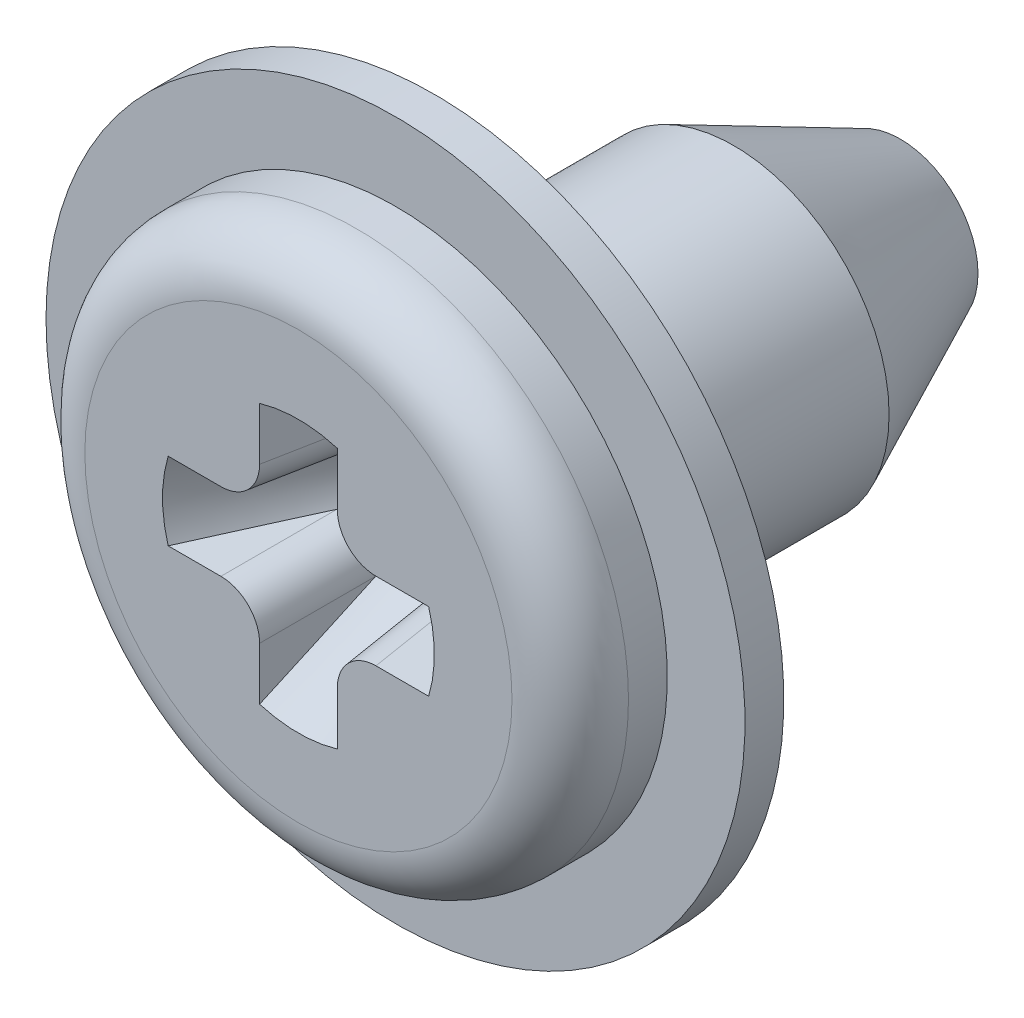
SolidWorks part; units mm, degrees
ref_plane "Plan1" through (0, 0, 0) normal (0, 0, 1) x (1, 0, 0)
ref_plane "Plan2" through (0, 0, 0) normal (0, 1, 0) x (1, 0, 0)
ref_plane "Plan3" through (0, 0, 0) normal (1, 0, 0) x (0, 0, -1)
sketch "Esquisse1" plane through (0, 0, 0) normal (0, 0, 1) x (1, 0, 0)
  circle A0 centre (0, 0) radius 2
  dimension "D1" = 4
extrude "Base-Extrusion" add sketch "Esquisse1" along normal blind 6
sketch "Esquisse2" plane through (0, 0, 6) normal (0, 0, 1) x (1, 0, 0)
  circle A2 centre (0, 0) radius 3.5
  circle A3 centre (0, 0) radius 3.5
  dimension "D1" = 1.5
extrude "Boss.-Extru.1" add sketch "Esquisse2" along normal blind 1.75
chamfer "Chanfrein1" distance 1 angle 65
sketch "Esquisse11" plane through (0, 0, 6) normal (0, 0, -1) x (-1, 0, 0)
  circle A0 centre (0, 0) radius 4.5
  dimension "D1" = 9
extrude "Boss.-Extru.7" add sketch "Esquisse11" against normal blind 0.5
sketch "Esquisse8" plane through (0, 0, 7.75) normal (0, 0, 1) x (1, 0, 0)
  circle A0 centre (0, 0) radius 1.75
  dimension "D1" = 3.5
extrude "Enlèv. mat.-Extru.4" cut sketch "Esquisse8" against normal blind 1.5 draft 30
sketch "Esquisse9" plane through (0, 0, 6.25) normal (0, 0, 1) x (1, 0, 0)
  circle A1 centre (0, 0) radius 0.884 construction
  circle A2 centre (0, 0) radius 0.884
extrude "Enlèv. mat.-Extru.5" cut sketch "Esquisse9" against normal blind 0.85 draft 45
sketch "Esquisse10" plane through (0, 0, 7.75) normal (0, 0, 1) x (1, 0, 0)
  line L0 (2.9698, 0) -> (-2.8626, 0) construction
  line L1 (0, 2.7331) -> (0, -2.6438) construction
  line L2 (0.5, 2) -> (0.5, 0.5)
  line L3 (0.5, 0.5) -> (2, 0.5)
  line L4 (-0.5, 2) -> (0.5, 2)
  line L5 (2, 0.5) -> (2, -0.5)
  line L6 (0.5, -2) -> (-0.5, -2)
  line L7 (0.5, -0.5) -> (2, -0.5)
  line L8 (0.5, -2) -> (0.5, -0.5)
  line L9 (-0.5, -2) -> (-0.5, -0.5)
  line L10 (-0.5, -0.5) -> (-2, -0.5)
  line L11 (-2, 0.5) -> (-2, -0.5)
  line L12 (-0.5, 0.5) -> (-2, 0.5)
  line L13 (-0.5, 2) -> (-0.5, 0.5)
  circle A0 centre (0, 0) radius 2.5
  point P13 (2.0588, 0)
  point P17 (0, -2)
  point P18 (0, 2)
  point P20 (-2.0588, 0)
  point P23 (0.5, 0.5)
  point P26 (-0.5, 0.5)
  point P29 (-0.5, -0.5)
  point P32 (0.5, -0.5)
  point P34 (0, 2)
  dimension "D1" = 1
  dimension "D2" = 2
  dimension "D3" = 5
extrude "Boss.-Extru.6" add sketch "Esquisse10" against normal blind 1.75 draft 5
fillet "Congé5" radius 0.5
fillet "Congé4" radius 0.75
